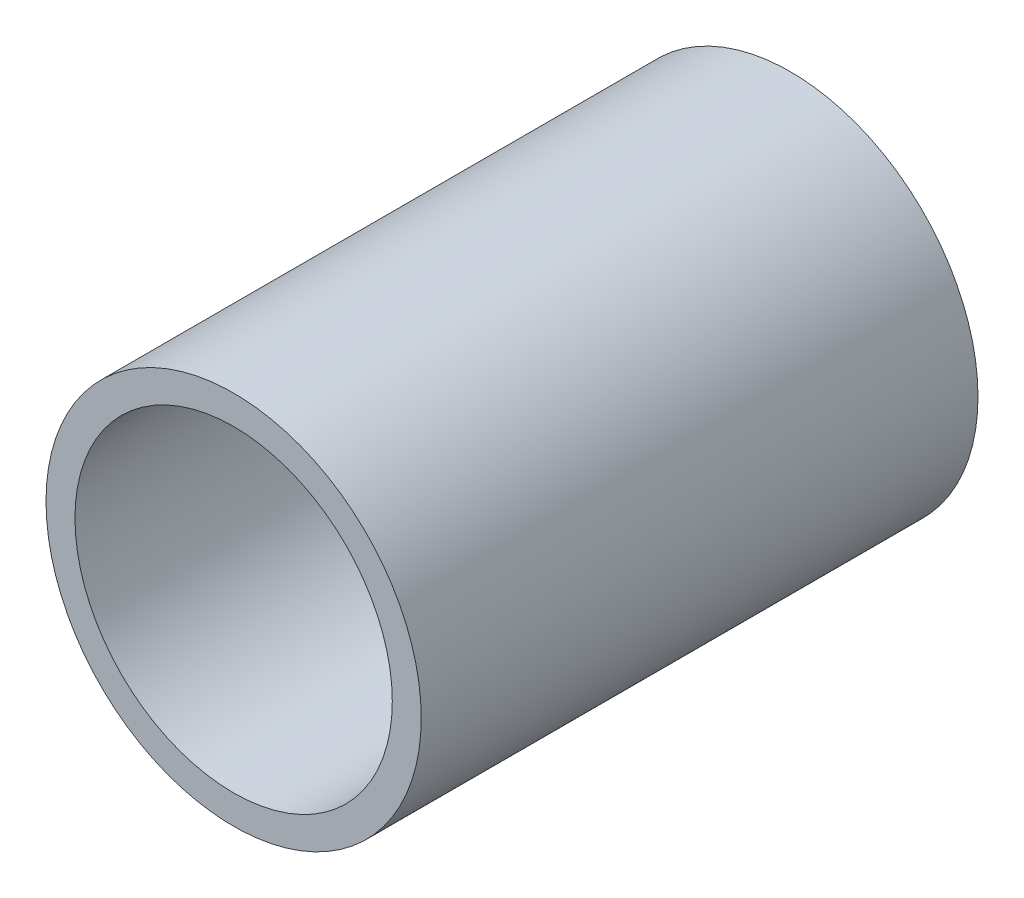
SolidWorks part; units mm, degrees
ref_plane "Vorne" through (0, 0, 0) normal (0, 0, 1) x (1, 0, 0)
ref_plane "Oben" through (0, 0, 0) normal (0, 1, 0) x (1, 0, 0)
ref_plane "Rechts" through (0, 0, 0) normal (1, 0, 0) x (0, 0, -1)
sketch "RohrSkizze" plane through (0, 0, 0) normal (0, 0, 1) x (1, 0, 0)
  circle A0 centre (0, 0) radius 16.85
  circle A1 centre (0, 0) radius 14.25
  dimension "AußenDurchmesser" = 33.7
  dimension "InnenDurchmesser" = 28.5
extrude "Lineare Austragung" add sketch "RohrSkizze" along normal blind 50
sketch "FilterSkizze" plane through (0, 0, 50) normal (0, 0, 1) x (1, 0, 0)
  circle A0 centre (0, 0) radius 16.85 construction
  dimension "NennDurchmesser" = 33.7
